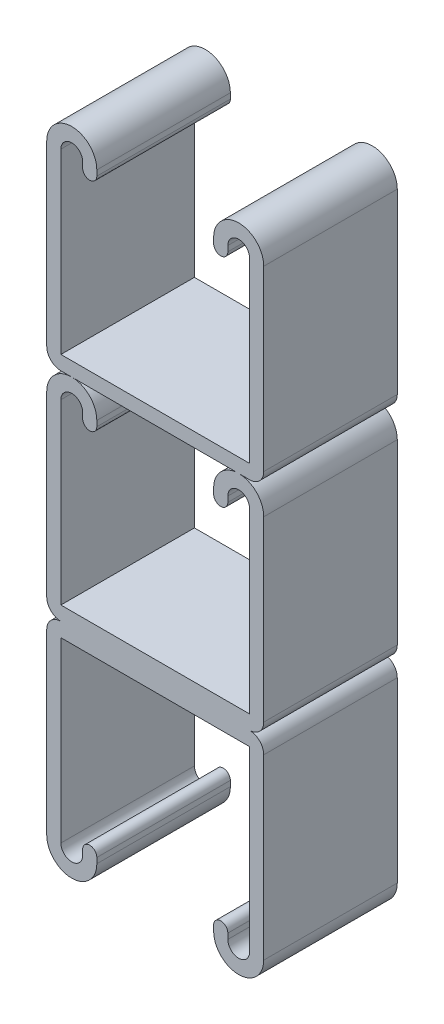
SolidWorks part; units mm, degrees
ref_plane "Plane1" through (0, 0, 0) normal (0, 0, 1) x (1, 0, 0)
ref_plane "Plane2" through (0, 0, 0) normal (0, 1, 0) x (1, 0, 0)
ref_plane "Plane3" through (0, 0, 0) normal (1, 0, 0) x (0, 0, -1)
sketch "Sketch1" plane through (0, 0, 0) normal (0, 0, 1) x (1, 0, 0)
  line L0 (-20.6375, 36.5125) -> (-20.6375, 2.6924)
  line L1 (-17.9451, 0) -> (17.9451, 0)
  line L2 (20.6375, 2.6924) -> (20.6375, 36.5125)
  line L3 (11.1125, 36.5125) -> (11.1125, 35.4774)
  line L4 (-11.1125, 36.5125) -> (-11.1125, 35.4774)
  line L5 (-13.8049, 36.5125) -> (-13.8049, 35.4774)
  line L6 (-17.9451, 36.5125) -> (-17.9451, 2.6924)
  line L7 (-17.9451, 2.6924) -> (17.9451, 2.6924)
  line L8 (17.9451, 2.6924) -> (17.9451, 36.5125)
  line L9 (13.8049, 36.5125) -> (13.8049, 35.4774)
  line L10 (-25.4, 41.275) -> (25.4, 41.275) construction
  line L11 (-12.8524, 34.1313) -> (12.8524, 34.1313) construction
  arc A0 (20.6375, 36.5125) -> (11.1125, 36.5125) centre (15.875, 36.5125) ccw
  arc A1 (-20.6375, 36.5125) -> (-11.1125, 36.5125) centre (-15.875, 36.5125) cw
  arc A2 (-17.9451, 0) -> (-20.6375, 2.6924) centre (-17.9451, 2.6924) cw
  arc A3 (17.9451, 0) -> (20.6375, 2.6924) centre (17.9451, 2.6924) ccw
  arc A4 (-17.9451, 36.5125) -> (-13.8049, 36.5125) centre (-15.875, 36.5125) cw
  arc A5 (17.9451, 36.5125) -> (13.8049, 36.5125) centre (15.875, 36.5125) ccw
  arc A6 (11.1125, 35.4774) -> (13.8049, 35.4774) centre (12.4587, 35.4774) ccw
  arc A7 (-11.1125, 35.4774) -> (-13.8049, 35.4774) centre (-12.4587, 35.4774) cw
  dimension "D1" = 2.6924
  dimension "D3" = 20.6375
  dimension "Width" = 41.275
  dimension "D6" = 9.525
  dimension "D7" = 22.225
  dimension "D8" = 41.275
  dimension "D9" = 7.1437
  dimension "gauge" = 2.6924
extrude "Base-Extrude" add sketch "Sketch1" along normal mid plane 25.4
mirror "Mirror1" about plane through (0, 0, 0) normal (0, 1, 0) of "Base-Extrude"
pattern_linear "LPattern1" count 2 spacing 41.2725 along (0, 1, 0) of "Base-Extrude"
equation "\"D3@Sketch1\" = \"Width@Sketch1\" / 2"
equation "\"D7@Sketch1\" = \"Width@Sketch1\" - 2 * \"D6@Sketch1\""
equation "\"D1@Sketch1\" = \"gauge@Sketch1\""
